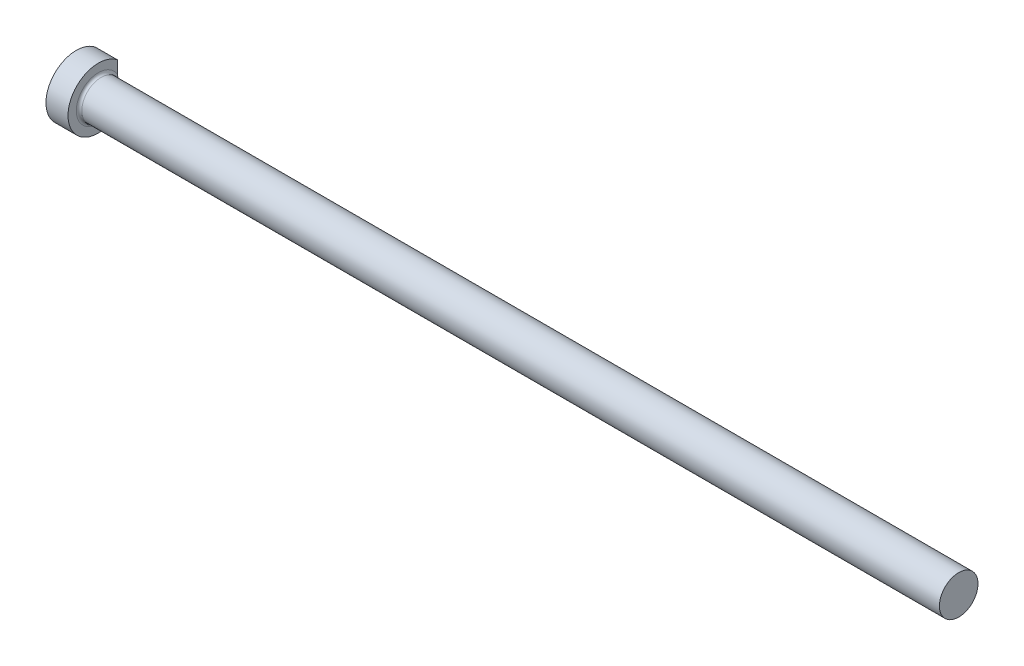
SolidWorks part; units mm, degrees
ref_plane "Front Plane" through (0, 0, 0) normal (0, 0, 1) x (1, 0, 0)
ref_plane "Top Plane" through (0, 0, 0) normal (0, 1, 0) x (1, 0, 0)
ref_plane "Right Plane" through (0, 0, 0) normal (1, 0, 0) x (0, 0, -1)
sketch "Sketch1" plane through (0, 0, 0) normal (0, 0, 1) x (1, 0, 0)
  line L0 (0, 0) -> (0, 8.7312)
  line L1 (0, 8.7312) -> (6.35, 8.7312)
  line L2 (6.35, 8.7312) -> (6.35, 6.3436)
  line L3 (7.1374, 5.5563) -> (254, 5.5562)
  line L4 (254, 5.5562) -> (254, 0)
  line L5 (254, 0) -> (0, 0)
  line L6 (254, 0) -> (0, 0) construction
  line L7 (0, 0) -> (-10.4771, 0) construction
  line L8 (254, 0) -> (1002.3976, 0) construction
  line L9 (7.1374, 5.5563) -> (-7.9138, 5.5562) construction
  arc A0 (7.1374, 5.5563) -> (6.35, 6.3436) centre (7.1374, 6.3436) cw
  dimension "D1" = 0.7874
  dimension "HeadDia" = 17.4625
  dimension "HeadThickness" = 6.35
  dimension "PinDia" = 11.1125
  dimension "overall" = 254
revolve "PIN" add sketch "Sketch1" angle 360 about L6
ref_plane "Plane1" through (130.5687, 0, -5.5562) normal (0, 0, -1) x (0, -1, 0)
ref_plane "CutPlane" through (0, 0, -5.5565) normal (0, 0, -1) x (-1, 0, 0)
other "SurfaceCut1"
